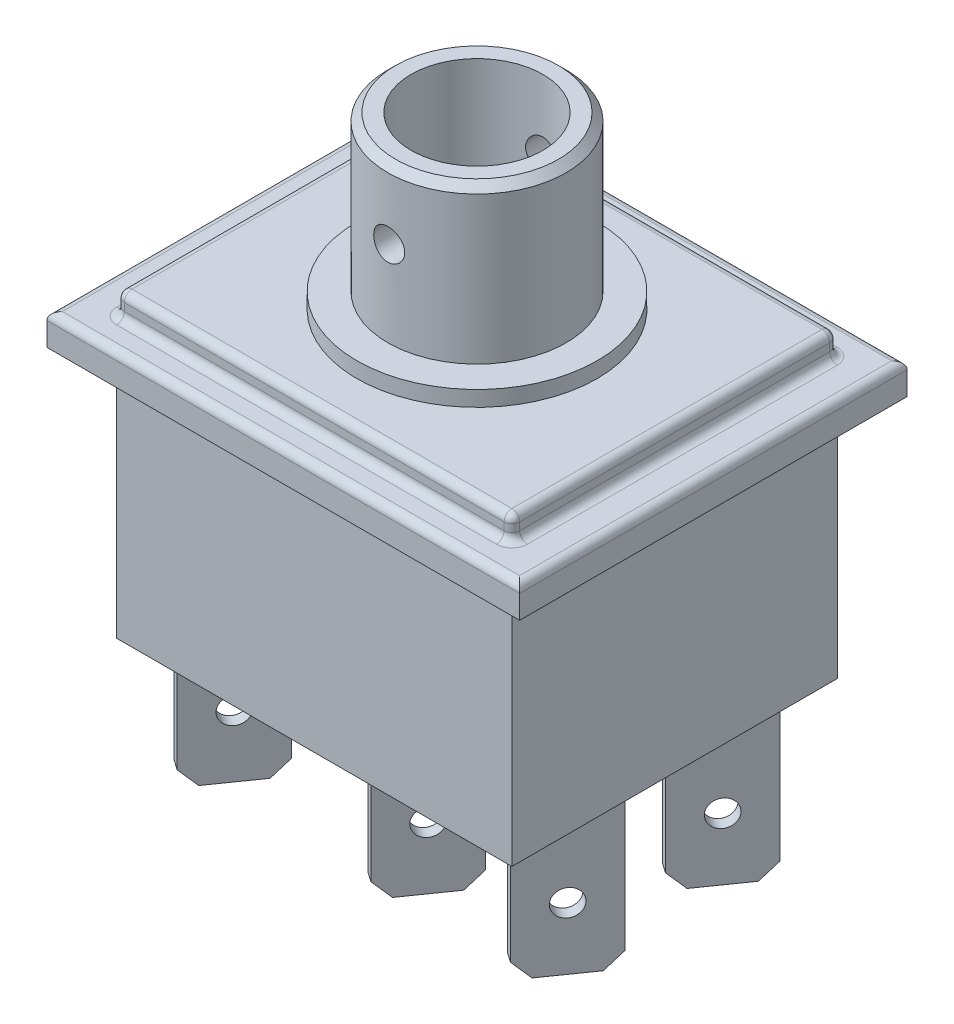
SolidWorks part; units mm, degrees
ref_plane "Plan1" through (0, 0, 0) normal (0, 0, 1) x (1, 0, 0)
ref_plane "Plan2" through (0, 0, 0) normal (0, 1, 0) x (1, 0, 0)
ref_plane "Plan3" through (0, 0, 0) normal (1, 0, 0) x (0, 0, -1)
sketch "Esquisse1" plane through (0, 0, 0) normal (0, 0, 1) x (1, 0, 0)
  line L0 (-12.75, 0) -> (12.75, 0)
  line L1 (12.75, 0) -> (12.75, -1.5)
  line L2 (12.75, -1.5) -> (15.25, -1.5)
  line L3 (15.25, -1.5) -> (15.25, -3.5)
  line L4 (15.25, -3.5) -> (12.75, -3.5)
  line L5 (12.75, -3.5) -> (12.75, -19.5)
  line L6 (12.75, -19.5) -> (-12.75, -19.5)
  line L7 (-12.75, -19.5) -> (-12.75, -3.5)
  line L8 (-12.75, -3.5) -> (-15.25, -3.5)
  line L9 (-15.25, -3.5) -> (-15.25, -1.5)
  line L10 (-15.25, -1.5) -> (-12.75, -1.5)
  line L11 (-12.75, -1.5) -> (-12.75, 0)
  line L12 (0, 15.3266) -> (0, -37.2809) construction
  dimension "D1" = 25.5
  dimension "D2" = 30.5
  dimension "D3" = 1.5
  dimension "D4" = 2
  dimension "D5" = 25.5
  dimension "D6" = 16
extrude "Base-Extrusion" add sketch "Esquisse1" along normal mid plane 25
sketch "Esquisse2" plane through (0, -19.5, 0) normal (0, -1, 0) x (1, 0, 0)
  line L0 (-16.1352, 0) -> (16.1352, 0) construction
  line L1 (-12.75, 12.5) -> (12.75, 12.5)
  line L2 (-12.75, 12.5) -> (-12.75, 10.5)
  line L3 (-12.75, 10.5) -> (12.75, 10.5)
  line L4 (12.75, 12.5) -> (12.75, 10.5)
  line L5 (-12.75, 12.5) -> (12.75, 12.5) construction
  line L6 (12.75, 12.5) -> (12.75, -12.5) construction
  line L7 (-12.75, 12.5) -> (-12.75, -12.5) construction
  line L8 (12.75, -12.5) -> (12.75, -10.5)
  line L9 (-12.75, -10.5) -> (12.75, -10.5)
  line L10 (-12.75, -12.5) -> (-12.75, -10.5)
  line L11 (-12.75, -12.5) -> (12.75, -12.5)
  dimension "D1" = 2
extrude "Enlèv. mat.-Extru.1" cut sketch "Esquisse2" against normal up to surface (16 mm away)
sketch "Esquisse3" plane through (0, 0, 0) normal (0, 1, 0) x (-1, 0, 0)
  line L0 (-16.6681, 0) -> (16.6681, 0) construction
  line L1 (-12.75, 12.5) -> (12.75, 12.5)
  line L2 (-12.75, 12.5) -> (-12.75, 10.5)
  line L3 (-12.75, 10.5) -> (12.75, 10.5)
  line L4 (12.75, 12.5) -> (12.75, 10.5)
  line L5 (-12.75, 12.5) -> (12.75, 12.5) construction
  line L6 (12.75, 12.5) -> (12.75, -12.5) construction
  line L7 (-12.75, 12.5) -> (-12.75, -12.5) construction
  line L8 (12.75, -12.5) -> (12.75, -10.5)
  line L9 (-12.75, -10.5) -> (12.75, -10.5)
  line L10 (-12.75, -12.5) -> (-12.75, -10.5)
  line L11 (-12.75, -12.5) -> (12.75, -12.5)
  dimension "D1" = 2
extrude "Enlèv. mat.-Extru.2" cut sketch "Esquisse3" against normal up to surface (1.5 mm away)
fillet "Congé2" radius 0.5
sketch "Esquisse4" plane through (0, 0, 0) normal (0, 1, 0) x (-1, 0, 0)
  circle A0 centre (0, 0) radius 7.75
  dimension "D1" = 15.5
extrude "Boss.-Extru.1" add sketch "Esquisse4" along normal blind 1
sketch "Esquisse5" plane through (0, 1, 0) normal (0, 1, 0) x (-1, 0, 0)
  circle A0 centre (0, 0) radius 5.75
  circle A1 centre (0, 0) radius 4.25
  dimension "D1" = 11.5
  dimension "D2" = 8.5
extrude "Boss.-Extru.2" add sketch "Esquisse5" along normal blind 10
chamfer "Chanfrein1" distance 0.5 angle 45
sketch "Esquisse6" plane through (0, 0, 0) normal (0, 0, 1) x (1, 0, 0)
  line L0 (0, 1) -> (0, 0) construction
  line L1 (4.25, 11) -> (-4.25, 11) construction
  circle A0 centre (0, 6.5) radius 1
  dimension "D1" = 4.5
  dimension "D2" = 2
extrude "Enlèv. mat.-Extru.3" cut sketch "Esquisse6" against normal through all and the other way through all
sketch "Esquisse7" plane through (0, -19.5, 0) normal (0, -1, 0) x (1, 0, 0)
  line L0 (9.23, 7.1708) -> (12.27, 2.8292) construction
  line L1 (9.5577, 7.4002) -> (12.5976, 3.0587)
  line L2 (12.5976, 3.0587) -> (11.9423, 2.5998)
  line L3 (11.9423, 2.5998) -> (8.9024, 6.9413)
  line L4 (8.9024, 6.9413) -> (9.5577, 7.4002)
  line L5 (0, 3.0335) -> (0, -3.0335) construction
  line L6 (-3.291, 0) -> (3.291, 0) construction
  line L7 (10.4223, 4.7706) -> (11.0777, 5.2294) construction
  line L8 (12.75, 10.5) -> (12.75, -10.5) construction
  point P13 (10.75, 5)
  dimension "D1" = 5.3
  dimension "D2" = 0.8
  dimension "D3" = 35
  dimension "D4" = 5
  dimension "D5" = 2
extrude "Boss.-Extru.3" add sketch "Esquisse7" along normal blind 9.5
sketch "Esquisse8" plane through (9.8903, 0, 6.9252) normal (0.8192, 0, 0.5736) x (0.5736, 0, -0.8192)
  line L0 (2.0702, -23.7948) -> (2.0702, -29.9344) construction
  line L1 (4.7202, -29) -> (4.7202, -19.5) construction
  line L2 (-0.5798, -29) -> (-0.5798, -19.5) construction
  line L3 (4.7202, -29) -> (-0.5798, -29) construction
  circle A0 centre (2.0702, -25) radius 0.85
  dimension "D1" = 1.7
  dimension "D2" = 4
extrude "Enlèv. mat.-Extru.4" cut sketch "Esquisse8" against normal through all
chamfer "Chanfrein2" distance 1 angle 45
pattern_linear "Répétition linéaire3"
pattern_linear "Répétition linéaire1" count 2 spacing 10
pattern_linear "Répétition linéaire2" count 2 spacing 9
